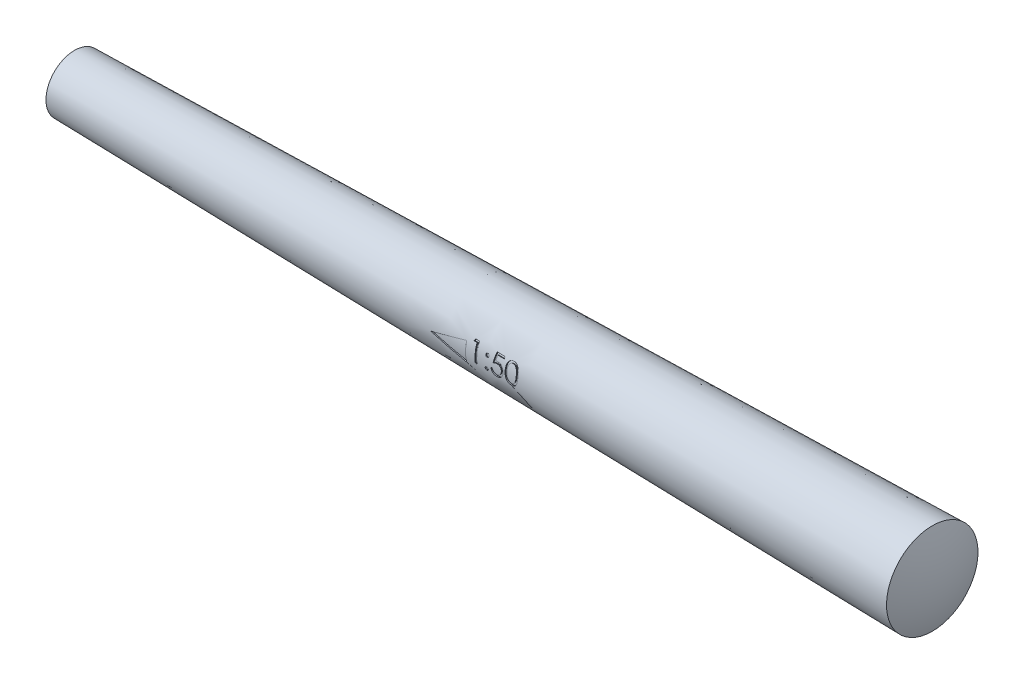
SolidWorks part; units mm, degrees
ref_plane "Front Plane" through (0, 0, 0) normal (0, 0, 1) x (1, 0, 0)
ref_plane "Top Plane" through (0, 0, 0) normal (0, 1, 0) x (1, 0, 0)
ref_plane "Right Plane" through (0, 0, 0) normal (1, 0, 0) x (0, 0, -1)
sketch "Sketch1" plane through (0, 0, 0) normal (1, 0, 0) x (0, 0, -1)
  circle A0 centre (0, 0) radius 1.5
  dimension "D1" = 3
extrude "Extrude1" add sketch "Sketch1" along normal mid plane 45
draft "Draft1" type of draft neutral plane draft angle 1.146 faces to draft 1 parameters "D1"=1.146
sketch "Sketch2" plane through (0, 0, 0) normal (0, 0, 1) x (1, 0, 0)
  line L0 (-22.5, 0) -> (-22.5, 1.5)
  line L1 (-22.5, 1.5) -> (-22.5, -1.5) construction
  line L2 (-22.5, 0) -> (-22.95, 0)
  line L3 (-22.95, 0) -> (-22.95, -1.95) construction
  line L4 (22.5, 0) -> (22.5, 2.4)
  line L5 (22.5, -2.4) -> (22.5, 2.4) construction
  line L6 (22.5, 0) -> (22.95, 0)
  line L7 (22.95, 0) -> (22.95, -1.95) construction
  line L8 (-22.5, -1.5) -> (22.5, -2.4) construction
  arc A0 (-22.95, 0) -> (-22.5, 1.5) centre (-20.225, 0) cw
  arc A1 (22.95, 0) -> (22.5, 2.4) centre (16.3248, 0) ccw
  point P14 (0, -1.95)
revolve "Revolve1" add sketch "Sketch2" angle 360 about L2
sketch "Sketch5" plane through (0, 0, 0) normal (0, 0, 1) x (1, 0, 0)
  line L0 (0, 1.95) -> (0, -1.95) construction
  line L1 (22.5, 2.4) -> (-22.5, 1.5) construction
  line L2 (-22.5, -1.5) -> (22.5, -2.4) construction
ref_plane "Plane2" through (0, 0, 0) normal (-0.02, 0, 0.9998) x (0.9998, 0, 0.02)
sketch "Sketch6" plane through (0, 0, 0) normal (-0.02, 0, 0.9998) x (0.9998, 0, 0.02)
  line L0 (0, 0) -> (0, 0.5)
  line L1 (0, 1.95) -> (0, -1.95) construction
  line L2 (0, 0.5) -> (-1.866, 0)
  line L3 (-1.866, 0) -> (0, -0.5)
  line L4 (0, -0.5) -> (0, 0)
  line L5 (0, -0.25) -> (3, -0.25) construction
  text T0 "1:50" font "Century Gothic" height 1
  dimension "D1" = 1
  dimension "D2" = 30
  dimension "D3" = 3
wrap "Wrap2" sketch "Sketch6" wrap type deboss source sketch "Sketch6" thickness 0.05 parameters "D1"=0.05
equation "\"D2@Sketch2\" = \"D1@Sketch2\""
